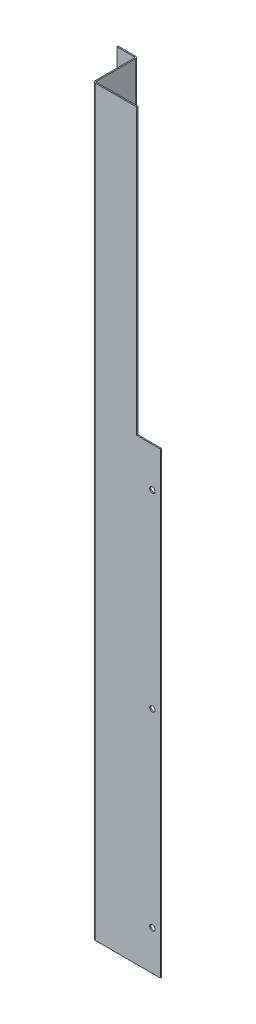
SolidWorks part; units mm, degrees
ref_plane "Plan de face" through (0, 0, 0) normal (0, 0, 1) x (1, 0, 0)
ref_plane "Plan de dessus" through (0, 0, 0) normal (0, 1, 0) x (1, 0, 0)
ref_plane "Plan de droite" through (0, 0, 0) normal (1, 0, 0) x (0, 0, -1)
mirrored part "CD032027 (580)_Rendre symétrique"
other "<CD032027 (580)>-<Enlèv. mat.-Extru.1>"
